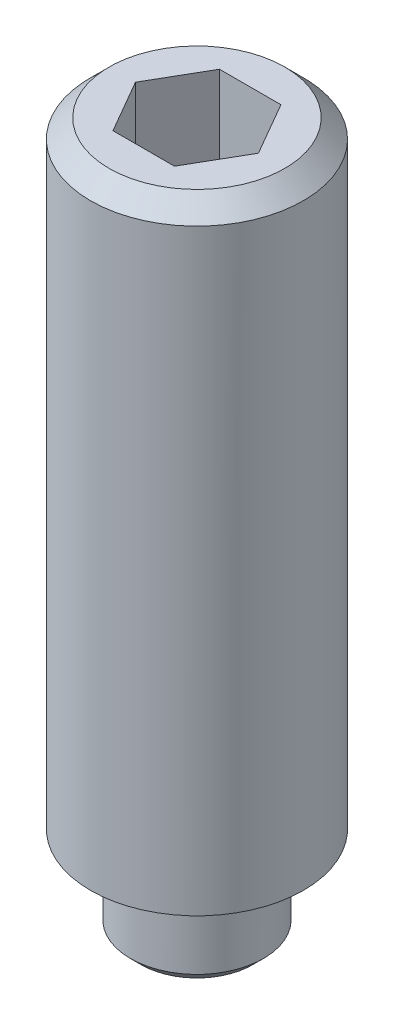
SolidWorks part; units mm, degrees
ref_plane "Plane1" through (0, 0, 0) normal (0, 0, 1) x (1, 0, 0)
ref_plane "Plane2" through (0, 0, 0) normal (0, 1, 0) x (1, 0, 0)
ref_plane "Plane3" through (0, 0, 0) normal (1, 0, 0) x (0, 0, -1)
sketch "Esquisse1" plane through (0, 0, 0) normal (0, 1, 0) x (1, 0, 0)
  circle A0 centre (0, 0) radius 2
  dimension "D1" = 4
extrude "Longueur filté" add sketch "Esquisse1" along normal blind 12
chamfer "Chanfrein1" distance 0.35 angle 45 1 edges at (0, 12, 2)
sketch "Esquisse6" plane through (0, 12, 0) normal (0, -1, 0) x (-1, 0, 0)
  line L1 (1.1547, 0) -> (0.5774, 1)
  line L2 (0.5774, 1) -> (-0.5774, 1)
  line L3 (-0.5774, 1) -> (-1.1547, 0)
  line L4 (-1.1547, 0) -> (-0.5774, -1)
  line L5 (-0.5774, -1) -> (0.5774, -1)
  line L6 (0.5774, -1) -> (1.1547, 0)
  circle A0 centre (0, 0) radius 1 construction
  dimension "S" = 2
extrude "Enlèv. mat.-Extru.4" cut sketch "Esquisse6" along normal blind 2.5
sketch "Esquisse7" plane through (0, 0, 0) normal (0, -1, 0) x (1, 0, 0)
  circle A0 centre (0, 0) radius 1.25
  dimension "Dz" = 2.5
extrude "Enlèv. mat.-Extru.6" cut sketch "Esquisse7" against normal through all draft 60 flip side to cut
sketch "Esquisse8" plane through (0, 0, 0) normal (0, -1, 0) x (1, 0, 0)
  circle A0 centre (0, 0) radius 1.25
  circle A1 centre (0, 0) radius 1.25 construction
extrude "Extrusion1" add sketch "Esquisse8" along normal blind 1.25
chamfer "Chanfrein2" distance 0.2 angle 45 1 edges at (0, -1.25, -1.25)
equation "\"Ch@Chanfrein1\" = (\"D1@Esquisse1\"-\"D2@Représentation de filetage1\")/2"
